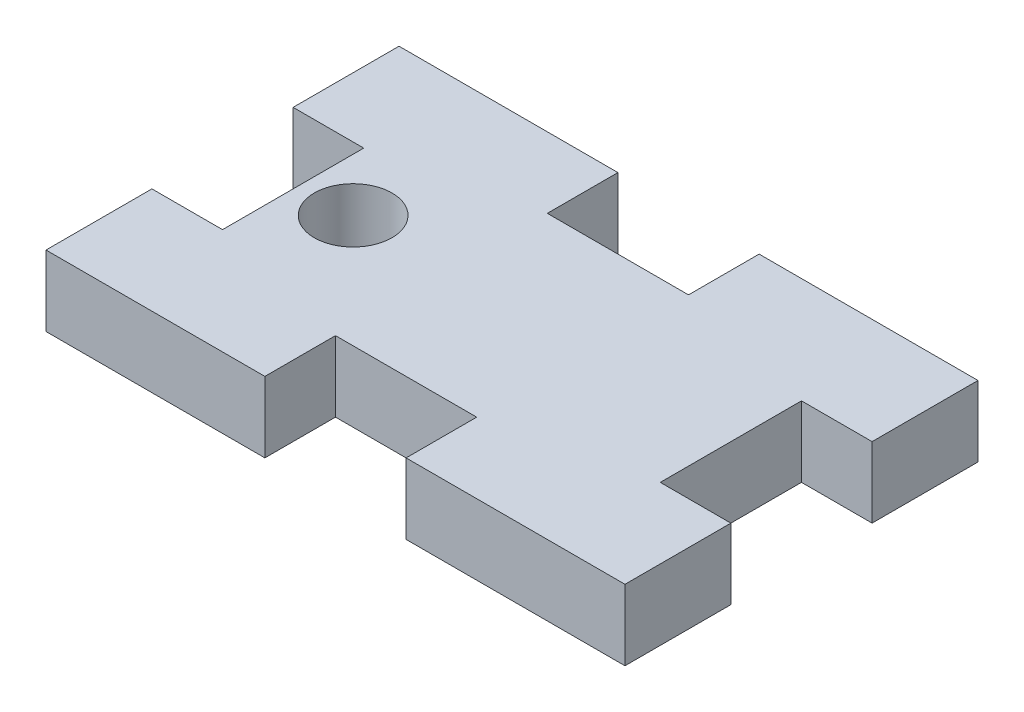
SolidWorks part; units mm, degrees
ref_plane "Plan de face" through (0, 0, 0) normal (0, 0, 1) x (1, 0, 0)
ref_plane "Plan de dessus" through (0, 0, 0) normal (0, 1, 0) x (1, 0, 0)
ref_plane "Plan de droite" through (0, 0, 0) normal (1, 0, 0) x (0, 0, -1)
sketch "Esquisse1" plane through (0, 0, 0) normal (0, 1, 0) x (1, 0, 0)
  line L1 (-20.5, 12.5) -> (20.5, 12.5)
  line L2 (-20.5, 12.5) -> (-20.5, -12.5)
  line L3 (-20.5, -12.5) -> (20.5, -12.5)
  line L4 (20.5, 12.5) -> (20.5, -12.5)
  line L5 (-20.5, 12.5) -> (20.5, -12.5) construction
  line L6 (-20.5, -12.5) -> (20.5, 12.5) construction
  point P0 (0, 0)
  dimension "D1" = 41
  dimension "D2" = 25
extrude "Boss.-Extru.1" add sketch "Esquisse1" along normal blind 5
sketch "Esquisse2" plane through (0, 5, 0) normal (0, 1, 0) x (1, 0, 0)
  line L0 (-20.5, -12.5) -> (20.5, -12.5) construction
  line L1 (-5, -12.5) -> (5, -12.5)
  line L2 (-5, -12.5) -> (-5, -7.5)
  line L3 (-5, -7.5) -> (5, -7.5)
  line L4 (5, -12.5) -> (5, -7.5)
  point P6 (0, -12.5)
  dimension "D1" = 5
  dimension "D2" = 10
extrude "Enlèv. mat.-Extru.1" cut sketch "Esquisse2" against normal up to surface (5 mm away)
mirror "Symétrie1" about plane through (0, 0, 0) normal (0, 0, 1) of "Enlèv. mat.-Extru.1"
sketch "Esquisse3" plane through (0, 5, 0) normal (0, 1, 0) x (1, 0, 0)
  line L0 (-20.5, 12.5) -> (-20.5, -12.5) construction
  line L1 (-20.5, 5) -> (-15.5, 5)
  line L2 (-20.5, 5) -> (-20.5, -5)
  line L3 (-20.5, -5) -> (-15.5, -5)
  line L4 (-15.5, 5) -> (-15.5, -5)
  line L5 (5, -7.5) -> (-5, -7.5) construction
  line L6 (-5, -7.5) -> (-5, -12.5) construction
  point P6 (-20.5, 0)
extrude "Enlèv. mat.-Extru.2" cut sketch "Esquisse3" against normal up to next
mirror "Symétrie2" about plane through (0, 0, 0) normal (1, 0, 0) of "Enlèv. mat.-Extru.2"
sketch "Esquisse4" plane through (0, 5, 0) normal (0, 1, 0) x (1, 0, 0)
  line L0 (15.5, -5) -> (15.5, 5) construction
  line L1 (-20.5, -12.5) -> (-5, -12.5) construction
  circle A0 centre (-11.75, 0.5) radius 2.75
  point P2 (0, 0)
  dimension "D2" = 5.5
  dimension "D1" = 27.25
  dimension "D3" = 13
extrude "Enlèv. mat.-Extru.3" cut sketch "Esquisse4" against normal up to next
